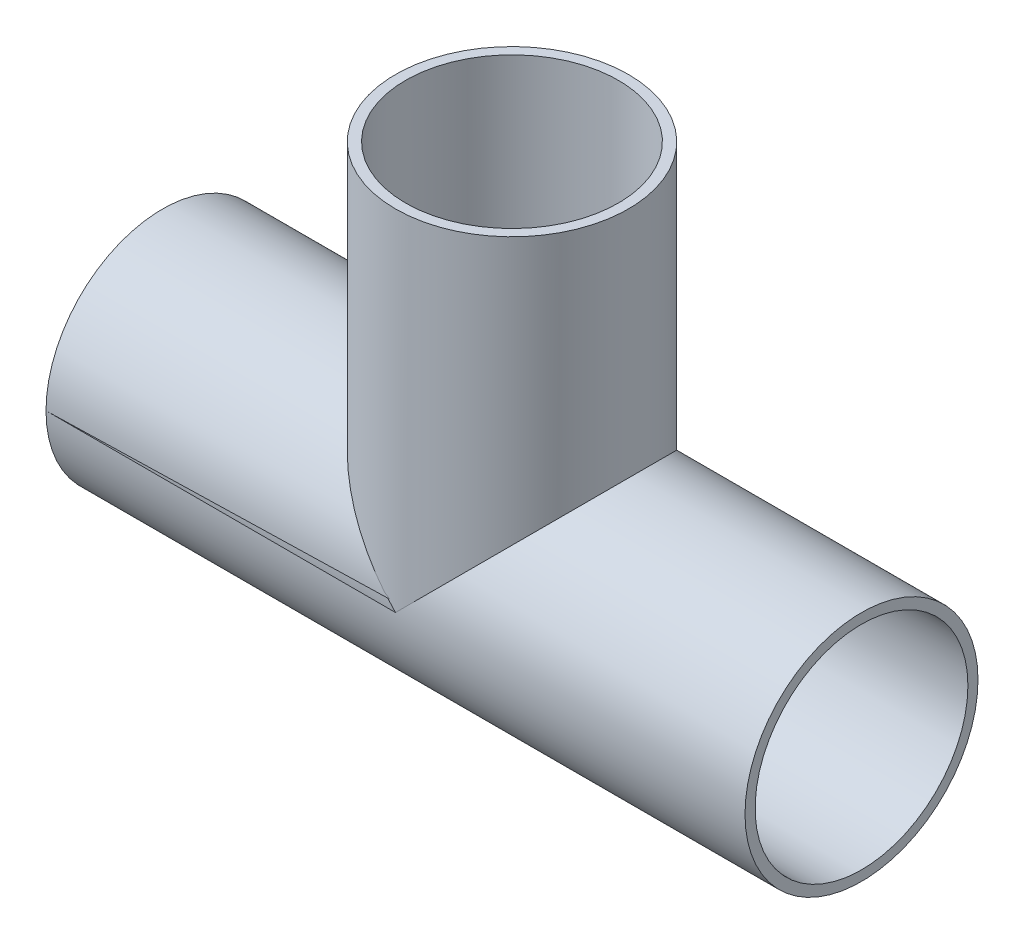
SolidWorks part; units mm, degrees
ref_plane "Front Plane" through (0, 0, 0) normal (0, 0, 1) x (1, 0, 0)
ref_plane "Top Plane" through (0, 0, 0) normal (0, 1, 0) x (1, 0, 0)
ref_plane "Right Plane" through (0, 0, 0) normal (1, 0, 0) x (0, 0, -1)
sketch "Sketch1" plane through (0, 0, 0) normal (0, 1, 0) x (1, 0, 0)
  circle A0 centre (0, 0) radius 19.05
extrude "Boss-Extrude1" add sketch "Sketch1" along normal blind 57.15
sketch "Sketch2" plane through (0, 0, 0) normal (1, 0, 0) x (0, 0, -1)
  circle A0 centre (0, 0) radius 19.05
extrude "Boss-Extrude2" add sketch "Sketch2" along normal mid plane 114.3
sketch "Sketch3" plane through (0, 57.15, 0) normal (0, 1, 0) x (1, 0, 0)
  circle A0 centre (0, 0) radius 17.399
extrude "Cut-Extrude1" cut sketch "Sketch3" against normal blind 57.15
sketch "Sketch4" plane through (57.15, 0, 0) normal (1, 0, 0) x (0, 0, -1)
  circle A0 centre (0, 0) radius 17.399
extrude "Cut-Extrude2" cut sketch "Sketch4" against normal through all
